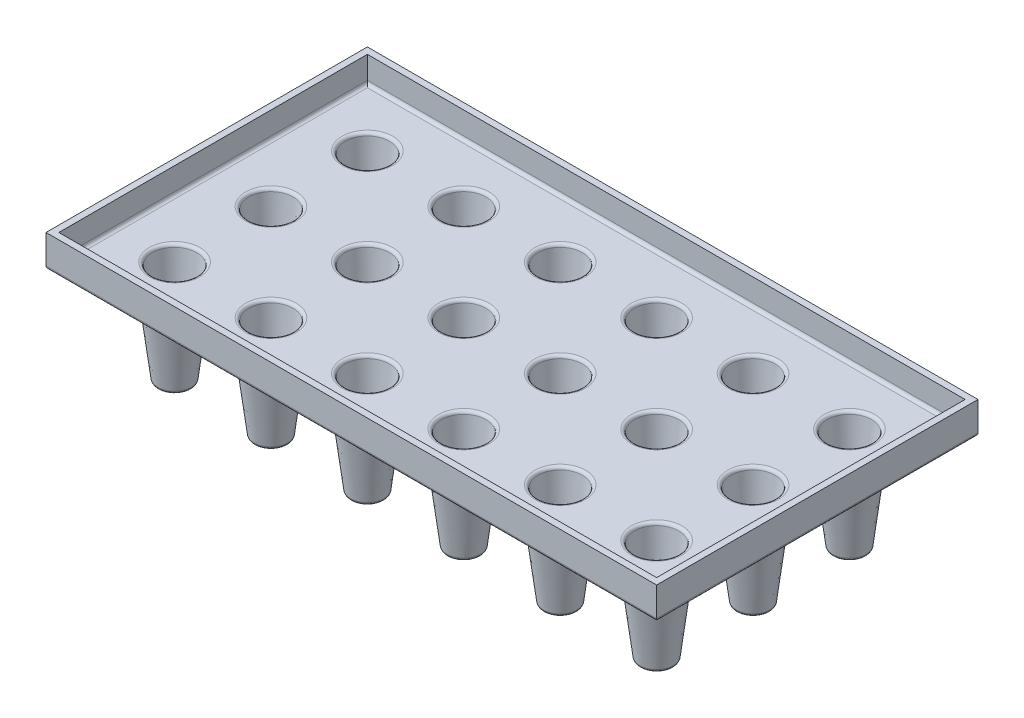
SolidWorks part; units mm, degrees
ref_plane "Front Plane" through (0, 0, 0) normal (0, 0, 1) x (1, 0, 0)
ref_plane "Top Plane" through (0, 0, 0) normal (0, 1, 0) x (1, 0, 0)
ref_plane "Right Plane" through (0, 0, 0) normal (1, 0, 0) x (0, 0, -1)
sketch "Sketch1" plane through (0, 0, 0) normal (0, 1, 0) x (1, 0, 0)
  line L1 (241.3, 127) -> (0, 127)
  line L2 (241.3, 127) -> (241.3, 0)
  line L3 (241.3, 0) -> (0, 0)
  line L4 (0, 127) -> (0, 0)
  line L5 (241.3, 127) -> (0, 0) construction
  line L6 (241.3, 0) -> (0, 127) construction
  point P0 (120.65, 63.5)
  dimension "D1" = 127
  dimension "D2" = 241.3
extrude "Boss-Extrude1" add sketch "Sketch1" along normal blind 12.7
sketch "Sketch2" plane through (0, 12.7, 0) normal (0, 1, 0) x (1, 0, 0)
  line L0 (0, 0) -> (241.3, 0) construction
  line L1 (0, 127) -> (0, 0) construction
  circle A0 centre (25.4, 25.4) radius 12.7
  dimension "D3" = 25.4
  dimension "D1" = 25.4
  dimension "D2" = 25.4
extrude "Boss-Extrude2" add sketch "Sketch2" against normal blind 50.8 draft 7
pattern_linear "LPattern1" count 6 spacing 38.1 along (1, 0, 0) count 3 spacing 38.1 along (0, 0, -1) of "Boss-Extrude2"
shell "Shell1" thickness 2.54
fillet "Fillet1" radius 1.27 80 edges at (215.9, -38.1, -95.1375) (215.9, 0, -112.7406) (177.8, -38.1, -95.1375) (177.8, 0, -112.7406) (139.7, -38.1, -95.1375) (139.7, 0, -112.7406) (101.6, -38.1, -95.1375) (101.6, 0, -112.7406) (63.5, -38.1, -95.1375) (63.5, 0, -112.7406) (25.4, -38.1, -95.1375) (25.4, 0, -112.7406) (215.9, -38.1, -57.0375) (215.9, 0, -74.6406) (177.8, -38.1, -57.0375) (177.8, 0, -74.6406) (139.7, -38.1, -57.0375) (139.7, 0, -74.6406) (101.6, -38.1, -57.0375) (101.6, 0, -74.6406) (63.5, -38.1, -57.0375) (63.5, 0, -74.6406) (25.4, -38.1, -57.0375) (25.4, 0, -74.6406) (215.9, -38.1, -18.9375) (215.9, 0, -36.5406) (177.8, -38.1, -18.9375) (177.8, 0, -36.5406) (139.7, -38.1, -18.9375) (139.7, 0, -36.5406) (101.6, -38.1, -18.9375) (101.6, 0, -36.5406) (63.5, 0, -36.5406) (25.4, 0, -36.5406) (120.65, 0, -127) (241.3, 0, -63.5) (120.65, 0, 0) (0, 0, -63.5) (25.4, -38.1, -18.9375) (63.5, -38.1, -18.9375) (215.9, -35.56, -97.3847) (215.9, 2.54, -110.4934) (177.8, -35.56, -97.3847) (177.8, 2.54, -110.4934) (139.7, -35.56, -97.3847) (139.7, 2.54, -110.4934) (101.6, -35.56, -97.3847) (101.6, 2.54, -110.4934) (63.5, -35.56, -97.3847) (63.5, 2.54, -110.4934) (25.4, -35.56, -97.3847) (25.4, 2.54, -110.4934) (215.9, -35.56, -59.2847) (215.9, 2.54, -72.3934) (177.8, -35.56, -59.2847) (177.8, 2.54, -72.3934) (139.7, -35.56, -59.2847) (139.7, 2.54, -72.3934) (101.6, -35.56, -59.2847) (101.6, 2.54, -72.3934) (63.5, -35.56, -59.2847) (63.5, 2.54, -72.3934) (25.4, -35.56, -59.2847) (25.4, 2.54, -72.3934) (215.9, -35.56, -21.1847) (215.9, 2.54, -34.2934) (177.8, -35.56, -21.1847) (177.8, 2.54, -34.2934) (139.7, -35.56, -21.1847) (139.7, 2.54, -34.2934) (101.6, -35.56, -21.1847) (101.6, 2.54, -34.2934) (63.5, 2.54, -34.2934) (25.4, 2.54, -34.2934) (120.65, 2.54, -124.46) (238.76, 2.54, -63.5) (120.65, 2.54, -2.54) (2.54, 2.54, -63.5) (25.4, -35.56, -21.1847) (63.5, -35.56, -21.1847)
